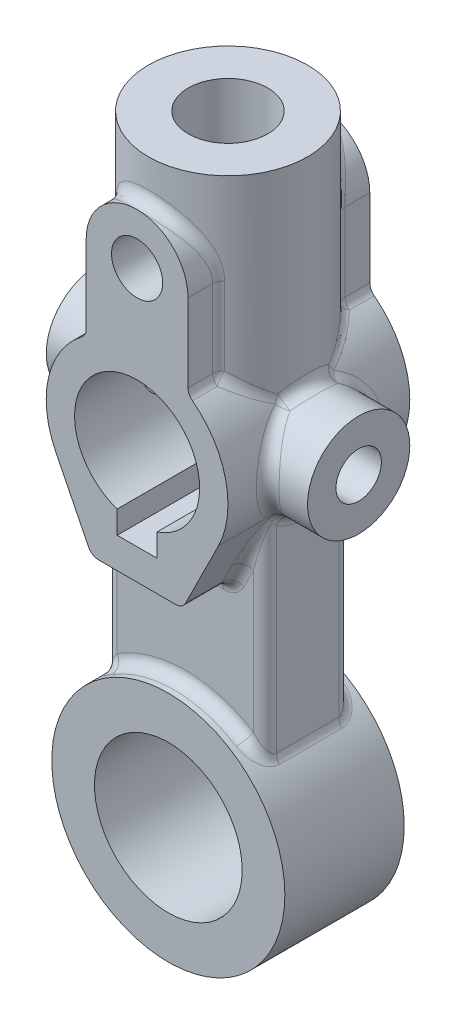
SolidWorks part; units mm, degrees
ref_plane "Front" through (0, 0, 0) normal (0, 0, 1) x (1, 0, 0)
ref_plane "Top" through (0, 0, 0) normal (0, 1, 0) x (1, 0, 0)
ref_plane "Right" through (0, 0, 0) normal (1, 0, 0) x (0, 0, -1)
sketch "Sketch1" plane through (0, 0, 0) normal (0, 0, 1) x (1, 0, 0)
  line L0 (-14.224, 21.0437) -> (-14.224, 44.45)
  line L1 (14.224, 44.45) -> (14.224, 21.0437)
  line L2 (-22.7409, -11.3141) -> (-12.7, -31.496)
  line L3 (-12.7, -31.496) -> (12.7, -31.496)
  line L4 (12.7, -31.496) -> (22.7409, -11.3141)
  line L5 (0, 44.45) -> (0, -31.496) construction
  arc A0 (22.7409, -11.3141) -> (14.224, 21.0437) centre (0, 0) ccw
  arc A1 (-14.224, 44.45) -> (14.224, 44.45) centre (0, 44.45) cw
  arc A2 (-14.224, 21.0437) -> (-22.7409, -11.3141) centre (0, 0) ccw
  dimension "D1" = 14.224
  dimension "D2" = 25.4
  dimension "D3" = 31.496
  dimension "D4" = 25.4
  dimension "D5" = 44.45
extrude "Base-Extrude" add sketch "Sketch1" along normal mid plane 50.8
sketch "Sketch2" plane through (0, 0, 0) normal (0, 1, 0) x (1, 0, 0)
  circle A0 centre (0, 0) radius 22.225
  dimension "D1" = 44.45
extrude "Boss-Extrude1" add sketch "Sketch2" along normal blind 69.85
sketch "Sketch3" plane through (0, 0, 0) normal (0, 1, 0) x (1, 0, 0)
  line L0 (-22.225, -11.9126) -> (22.225, 11.9126) construction
  line L1 (-22.225, 11.9126) -> (22.225, 11.9126)
  line L2 (-22.225, 11.9126) -> (-22.225, -11.9126)
  line L3 (-22.225, -11.9126) -> (22.225, -11.9126)
  line L4 (22.225, 11.9126) -> (22.225, -11.9126)
  circle A0 centre (0, 0) radius 22.225 construction
  dimension "D1" = 23.8252
extrude "Boss-Extrude2" add sketch "Sketch3" against normal blind 95.25
sketch "Sketch4" plane through (0, 0, 0) normal (0, 0, 1) x (1, 0, 0)
  line L1 (-22.225, -95.25) -> (22.225, -95.25) construction
  circle A0 centre (0, -95.25) radius 32.5628
  dimension "D1" = 65.1256
extrude "Boss-Extrude3" add sketch "Sketch4" along normal mid plane 33.3502
sketch "Sketch5" plane through (0, 0, 0) normal (1, 0, 0) x (0, 0, -1)
  circle A0 centre (0, 0) radius 14.2875
  dimension "D1" = 28.575
extrude "Boss-Extrude4" add sketch "Sketch5" along normal mid plane 73.025
sketch "Sketch6" plane through (0, 0, 25.4) normal (0, 0, 1) x (1, 0, 0)
  line L0 (0, 0) -> (0, -31.496) construction
  line L2 (-5.5626, -22.9162) -> (5.5626, -22.9162)
  line L3 (5.5626, -22.9162) -> (5.5626, -16.5662)
  line L4 (-5.5626, -22.9162) -> (-5.5626, -16.5662)
  line L5 (-12.7, -31.496) -> (12.7, -31.496) construction
  arc A0 (5.5626, -16.5662) -> (-5.5626, -16.5662) centre (0, 0) ccw
  point P8 (0, -22.9162)
  dimension "D1" = 34.9504
  dimension "D2" = 6.35
  dimension "D3" = 11.1252
extrude "Cut-Extrude1" cut sketch "Sketch6" against normal through all
sketch "Sketch7" plane through (0, 0, 25.4) normal (0, 0, 1) x (1, 0, 0)
  line L0 (0, 69.85) -> (0, 13.3293) construction
  circle A0 centre (0, 44.45) radius 7.1501
  arc A2 (14.224, 44.45) -> (-14.224, 44.45) centre (0, 44.45) ccw construction
  dimension "D1" = 14.3002
extrude "Cut-Extrude2" cut sketch "Sketch7" against normal through all
sketch "Sketch8" plane through (6.1897, 69.85, -40.376) normal (0, 1, 0) x (-1, 0, 0)
  circle A0 centre (6.1897, 40.376) radius 11.1125
  circle A2 centre (6.1897, 40.376) radius 22.225 construction
  dimension "D1" = 22.225
extrude "Cut-Extrude3" cut sketch "Sketch8" against normal up to surface (52.3748 mm away)
sketch "Sketch9" plane through (36.5125, -45.083, -1.9651) normal (1, 0, 0) x (0, 0, -1)
  circle A0 centre (-1.9651, 45.083) radius 6.35
  circle A2 centre (-1.9651, 45.083) radius 14.2875 construction
  dimension "D1" = 12.7
extrude "Cut-Extrude4" cut sketch "Sketch9" against normal through all
sketch "Sketch10" plane through (-1.0053, -152.0146, 16.6751) normal (0, 0, 1) x (1, 0, 0)
  circle A0 centre (1.0053, 56.7646) radius 20.6375
  circle A1 centre (1.0053, 56.7646) radius 32.5628 construction
  dimension "D1" = 41.275
extrude "Cut-Extrude5" cut sketch "Sketch10" against normal through all
fillet "Fillet1" radius 3.175 14 edges at (12.7, -31.496, 18.6563) (-12.7, -31.496, 18.6563) (-14.224, 21.0437, 21.2386) (14.224, 21.0437, 21.2386) (-14.224, 21.0437, -21.2386) (-17.2145, 18.6767, -14.0574) (14.224, 21.0437, -21.2386) (18.4937, 17.411, 12.3262) (12.7, -31.496, -18.6563) (-12.7, -31.496, -18.6563) (-22.225, -41.9012, 11.9126) (22.225, -41.9012, 11.9126) (22.225, -41.9012, -11.9126) (-22.225, -41.9012, -11.9126)
fillet "Fillet2" radius 3.175 38 edges at (0, -31.496, 11.9126) (-16.313, -24.234, 11.9126) (0, -31.496, -11.9126) (-16.313, -24.234, -11.9126) (-22.225, -12.3512, -7.9598) (14.224, 33.5586, -17.0771) (-20.9563, 14.3525, -7.4017) (-14.224, 33.5586, 17.0771) (18.4937, 17.411, 12.3262) (-14.6703, 21.044, -16.6953) (-14.393, 21.6453, 16.935) (14.6703, 21.044, 16.6953) (14.393, 21.6453, -16.935) (16.313, -24.234, -11.9126) (16.313, -24.234, 11.9126) (22.225, -12.3512, 7.9598) (-12.4053, -31.0202, 11.9126) (-12.4053, -31.0202, -11.9126) (-21.2951, -14.2203, -10.9827) (-21.2951, -14.2203, 10.9827) (21.2951, -14.2203, -10.9827) (21.2951, -14.2203, 10.9827) (12.4053, -31.0202, 11.9126) (12.4053, -31.0202, -11.9126) (14.224, 33.5586, 17.0771) (1.7531, 58.5656, -22.1558) (-14.224, 33.5586, -17.0771) (1.7531, 30.3344, 22.1558) (20.6956, 14.7259, -8.102) (-20.1, 15.529, 9.4837) (-22.2221, 14.283, -0.3586) (22.1493, 14.1695, -1.8326) (22.225, -12.3512, -7.9598) (-22.225, -12.3512, 7.9598) (22.4705, -11.8578, -7.9703) (24.9685, -4.6617, -13.5056) (-22.4705, -11.8578, 7.9703) (-24.9685, 4.6617, -13.5056)
fillet "Fillet3" radius 3.175 8 edges at (0, -62.6872, -11.9126) (-22.225, -71.4511, 0) (0, -62.6872, 11.9126) (22.225, -71.4511, 0) (-21.7879, -71.0503, -10.3453) (-21.4188, -70.7231, 10.8517) (21.4188, -70.7231, -10.8517) (21.7879, -71.0503, 10.3453)
fillet "Fillet4" radius 3.175 40 edges at (-22.2221, 14.283, -0.3586) (-21.8469, 13.8974, 4.0822) (21.8469, 13.8974, -4.0822) (22.225, -14.2875, 0) (22.6478, -11.5013, -8.4766) (25.3998, 0.1076, -14.2871) (22.2305, -12.9111, 6.1186) (21.7855, 13.1451, 5.5982) (21.7721, 13.4342, -4.8638) (21.0544, 14.2081, 9.1718) (22.5574, -11.6831, 8.4809) (22.225, -13.0973, -7.2233) (22.225, -13.0973, 7.2233) (21.2951, -16.8356, 10.9827) (20.6975, -15.4213, -13.2277) (22.5574, -11.6831, -8.4809) (-22.5574, -11.6831, -8.4809) (-22.225, -14.2875, 0) (-22.6478, -11.5013, 8.4766) (-25.3998, -0.1076, -14.2871) (-21.782, 13.49, 4.7067) (-21.7855, 13.1451, -5.5982) (-22.2305, -12.9111, -6.1186) (-22.225, -13.0973, 7.2233) (-22.225, -13.0973, -7.2233) (-21.2951, -16.8356, -10.9827) (-20.6975, -15.4213, 13.2277) (-22.5574, -11.6831, 8.4809) (-21.0544, 14.2081, -9.1718) (-22.3092, -12.3709, 8.7376) (22.3092, -12.3709, 8.7376) (-22.3092, -12.3709, -8.7376) (22.3092, -12.3709, -8.7376) (25.3998, 0.1076, -14.2871) (22.6478, -11.5013, 8.4766) (-25.3998, -0.1076, -14.2871) (-22.6478, -11.5013, -8.4766)
